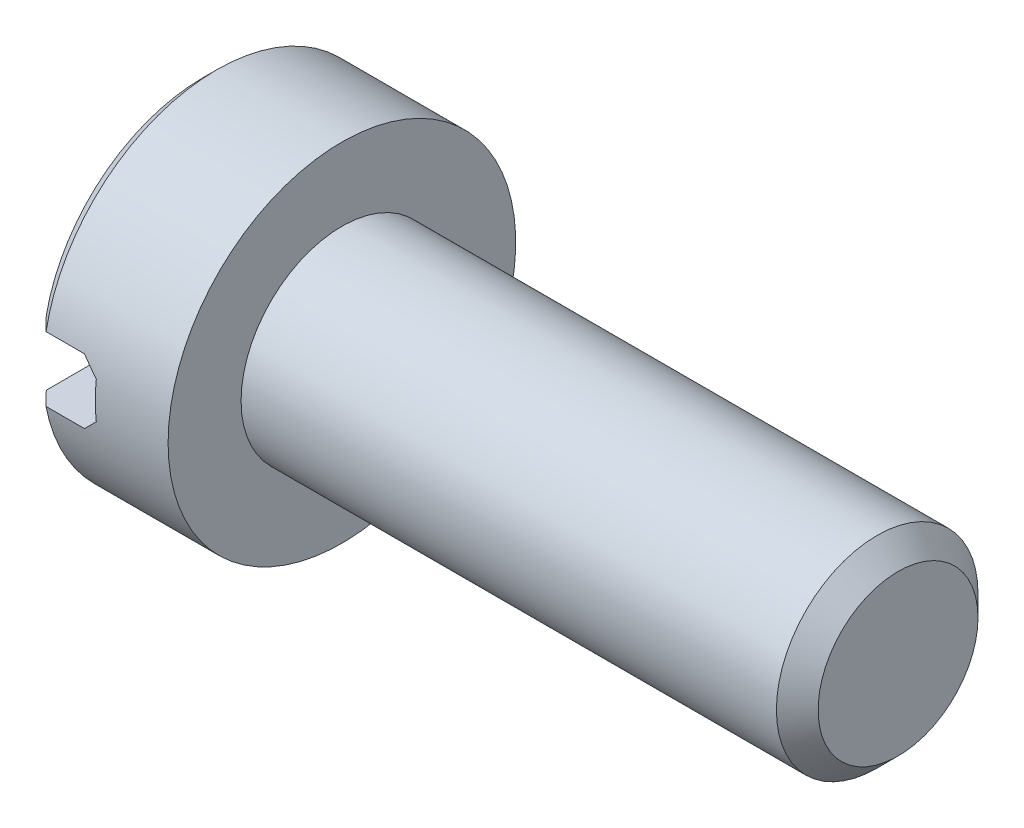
SolidWorks part; units mm, degrees
ref_plane "Face" through (0, 0, 0) normal (0, 0, 1) x (1, 0, 0)
ref_plane "Dessus" through (0, 0, 0) normal (0, 1, 0) x (1, 0, 0)
ref_plane "Droite" through (0, 0, 0) normal (1, 0, 0) x (0, 0, -1)
sketch "Esquisse1" plane through (0, 0, 0) normal (0, 0, 1) x (1, 0, 0)
  line L0 (0, 0) -> (0, 2.3)
  line L1 (0.2, 2.5) -> (2, 2.5)
  line L2 (2, 2.5) -> (2, 0)
  line L5 (0, 0) -> (7.6423, 0) construction
  line L7 (0, 2.3) -> (0.2, 2.5)
  line L8 (0, 0) -> (2, 0)
  point P1 (0, 2.5)
  dimension "D1" = 2.5
  dimension "D3" = 2
revolve "Révolution1" add sketch "Esquisse1" angle 360 about L5
sketch "Esquisse2" plane through (0, 0, 0) normal (0, 0, 1) x (1, 0, 0)
  line L0 (0, 2.3) -> (0, -2.3) construction
  line L1 (0, 0.4655) -> (0.7534, 0.4655)
  line L2 (0, 0.4655) -> (0, -0.4655)
  line L3 (0, -0.4655) -> (0.7534, -0.4655)
  line L4 (0.9534, 0.2655) -> (0.9534, -0.2655)
  line L5 (0.7534, 0.4655) -> (0.9534, 0.2655)
  line L6 (0.7534, -0.4655) -> (0.9534, -0.2655)
  point P1 (0.9534, -0.4655)
  point P3 (0.9534, 0.4655)
extrude "Enlèv. mat.-Extru.1" cut sketch "Esquisse2" against normal mid plane 10
sketch "Esquisse3" plane through (2, 0, 0) normal (1, 0, 0) x (0, 0, -1)
  circle A0 centre (0, 0) radius 1.45
extrude "Extrusion1" add sketch "Esquisse3" along normal blind 8
chamfer "Chanfrein1" distance 0.3 angle 45 1 edges at (10, 0, -1.45)
